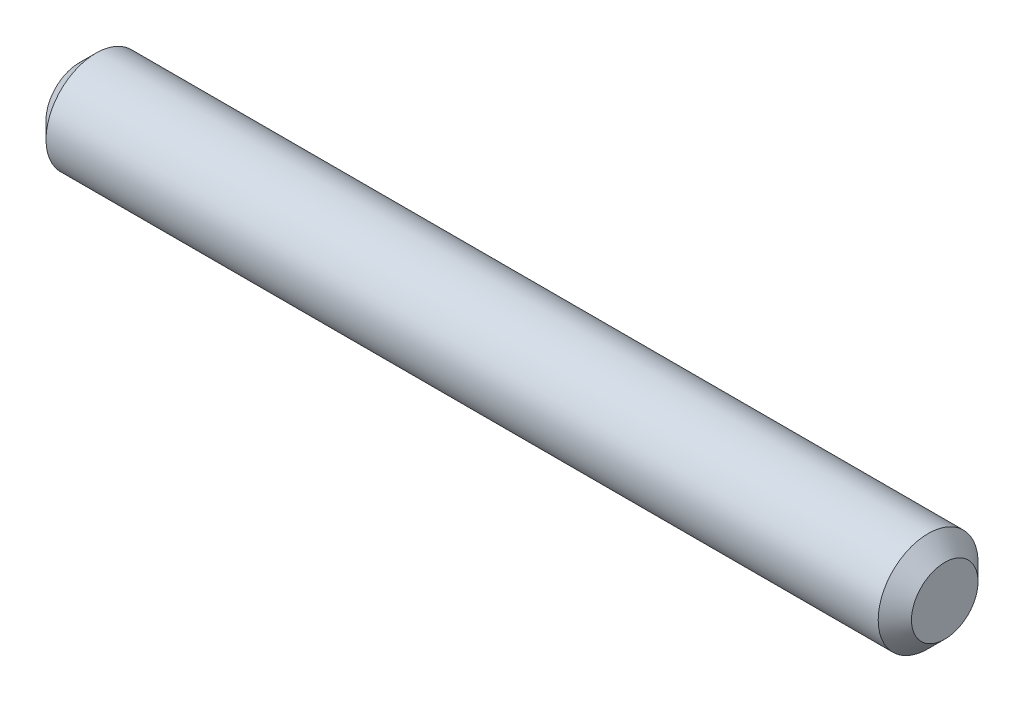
SolidWorks part; units mm, degrees
ref_plane "Front Plane" through (0, 0, 0) normal (0, 0, 1) x (1, 0, 0)
ref_plane "Top Plane" through (0, 0, 0) normal (0, 1, 0) x (1, 0, 0)
ref_plane "Right Plane" through (0, 0, 0) normal (1, 0, 0) x (0, 0, -1)
sketch "Sketch2" plane through (0, 0, 0) normal (0, 0, 1) x (1, 0, 0)
  line L0 (-13, 0) -> (13, 0)
  line L1 (-13, 0) -> (-13, 1)
  line L2 (-12.5, 1.5) -> (12.5, 1.5)
  line L3 (13, 1) -> (13, 0)
  line L4 (12.5, 1.5) -> (13, 1)
  line L5 (-13, 1) -> (-12.5, 1.5)
  point P3 (0, 0)
  point P4 (-13, 1.5)
  point P5 (13, 1.5)
  dimension "D1" = 1.5
  dimension "D2" = 26
revolve "Revolve1" add sketch "Sketch2" angle 360 about L0
